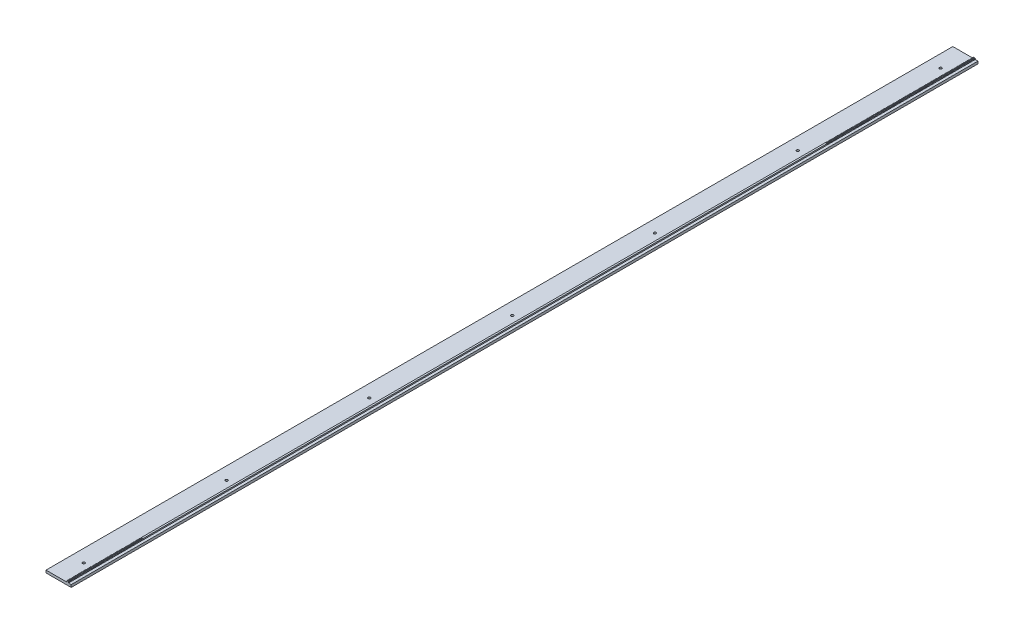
SolidWorks part; units mm, degrees
ref_plane "Front Plane" through (0, 0, 0) normal (0, 0, 1) x (1, 0, 0)
ref_plane "Top Plane" through (0, 0, 0) normal (0, 1, 0) x (1, 0, 0)
ref_plane "Right Plane" through (0, 0, 0) normal (1, 0, 0) x (0, 0, -1)
mirrored part "x axis_Mirrored"
other "<x axis>-<Hole7>"
